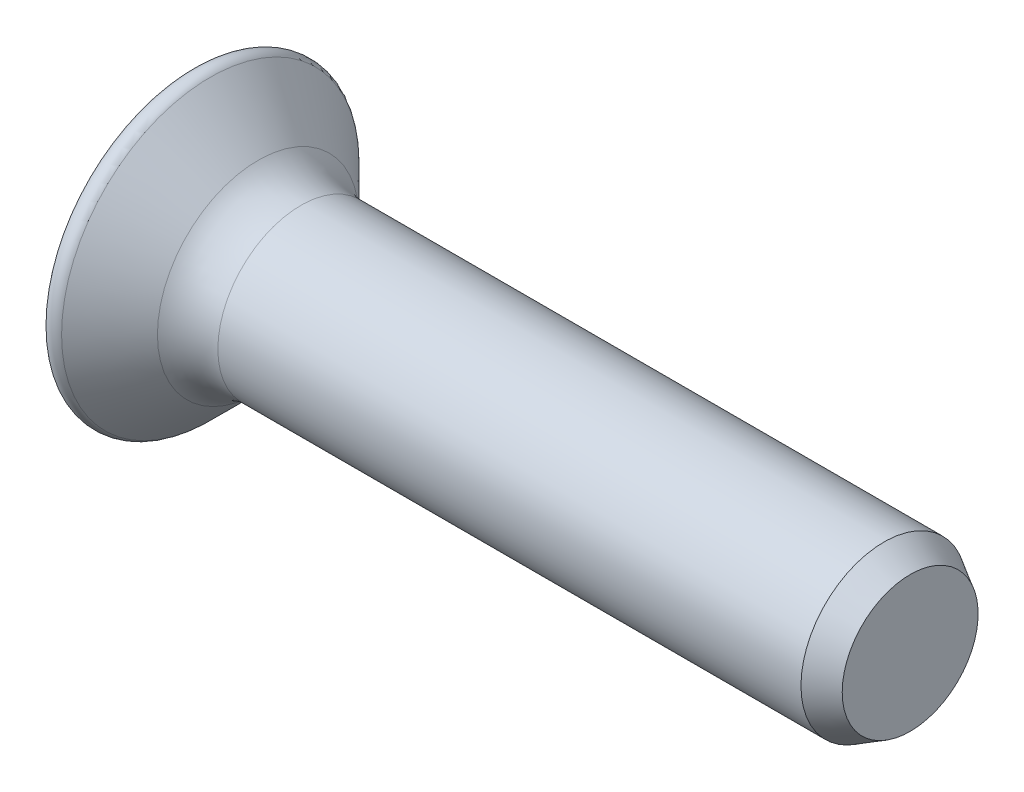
SolidWorks part; units mm, degrees
ref_plane "Front Plane" through (0, 0, 0) normal (0, 0, 1) x (1, 0, 0)
ref_plane "Top Plane" through (0, 0, 0) normal (0, 1, 0) x (1, 0, 0)
ref_plane "Right Plane" through (0, 0, 0) normal (1, 0, 0) x (0, 0, -1)
sketch "Sketch1" plane through (0, 0, 0) normal (0, 0, 1) x (1, 0, 0)
  line L0 (0, 0) -> (6.2784, 0) construction
  line L3 (-1.6, 0) -> (-1.6, -1.8061) construction
  line L4 (-1.6, 0) -> (8.4, 0)
  line L5 (0, 1.1) -> (8.4, 1.1)
  line L6 (8.4, 1.1) -> (8.4, 0)
  line L7 (0, 1.1) -> (-0.869, 1.969)
  arc A0 (-1.1, 1.9365) -> (-1.6, 0) centre (2.4, 0) ccw
  arc A1 (-1.1, 1.9365) -> (-0.869, 1.969) centre (-0.9723, 1.8658) cw
  dimension "D1" = 45
  dimension "rf" = 4
  dimension "l" = 9.5
  dimension "d" = 2.2
  dimension "k" = 1.1
  dimension "f" = 0.5
revolve "Revolve1" add sketch "Sketch1" angle 360 about L0
chamfer "Chamfer1" distance 0.2 angle 60 1 edges at (8.4, 0, 1.1)
sketch "Sketch5" plane through (0, 0, 0) normal (0, 0, 1) x (1, 0, 0)
  line L0 (0.3703, 0.825) -> (0.2069, 0.825)
  line L1 (0.2069, 0.825) -> (0.0481, 1.1)
  line L2 (0.3703, 0.825) -> (0.529, 1.1)
  line L3 (0.0481, 1.1) -> (0.0481, 1.35)
  line L4 (0.529, 1.1) -> (0.529, 1.35)
  line L5 (0.0481, 1.35) -> (0.529, 1.35)
  line L6 (0.2886, 0.825) -> (0.2886, 0) construction
  line L7 (0, 0) -> (7.3035, 0) construction
  line L9 (0, 1.1) -> (0, -1.1) construction
  line L12 (8.0536, 1.1) -> (0, 1.1) construction
  dimension "D2" = 60
  dimension "D3" = 0.25
  dimension "threadstart" = 0.2886
  dimension "minordia" = 1.65
  dimension "advance" = 0.4809
revolve "ThreadSchematic" [suppressed] cut sketch "Sketch5" angle 360 about L7
pattern_linear "ThdSchPat" [suppressed] count 18 spacing 0.4809 along (1, 0, 0)
sketch "Sketch2" plane through (0, 0, 0) normal (0, 0, 1) x (1, 0, 0)
  line L0 (0, 0) -> (5.7679, 0) construction
  line L1 (8.4, 0) -> (6.4947, 1.1)
  line L2 (8.4, 1.1) -> (8.4, 0) construction
  line L4 (6.4947, 1.1) -> (6.4947, 1.2)
  line L5 (6.4947, 1.2) -> (8.5, 1.2)
  line L6 (8.5, 1.2) -> (8.5, 0)
  line L7 (8.5, 0) -> (8.4, 0)
  point P5 (0, 1.1)
  dimension "D1" = 30
  dimension "D2" = 0.1
  dimension "D3" = 0.1
revolve "EndCone" [suppressed] cut sketch "Sketch2" angle 360 about L0
ref_plane "Plane4" through (-1.6, 0, 0) normal (1, 0, 0) x (0, 0, -1)
sketch "Sketch3" plane through (-1.6, 0, 0) normal (1, 0, 0) x (0, 0, -1)
  line L0 (0, 2.343) -> (0, -2.4842) construction
  line L1 (2.7661, 0) -> (-3.4558, 0) construction
  line L2 (-0.22, 1.1) -> (0.22, 1.1)
  line L3 (0.22, 1.1) -> (0.1467, 0.7333)
  line L4 (0, 0) -> (1.9578, 1.9578) construction
  line L5 (0.1467, 0.7333) -> (0.3614, 0.3614)
  line L6 (0.1467, 0.7333) -> (0, 0) construction
  line L7 (-0.1467, 0.7333) -> (-0.3614, 0.3614)
  line L8 (-0.22, 1.1) -> (-0.1467, 0.7333)
  line L9 (1.1, 0.22) -> (1.1, -0.22)
  line L10 (1.1, -0.22) -> (0.7333, -0.1467)
  line L11 (0.7333, -0.1467) -> (0.3614, -0.3614)
  line L12 (0.7333, 0.1467) -> (0.3614, 0.3614)
  line L13 (1.1, 0.22) -> (0.7333, 0.1467)
  line L14 (0.22, -1.1) -> (-0.22, -1.1)
  line L15 (-0.22, -1.1) -> (-0.1467, -0.7333)
  line L16 (-0.1467, -0.7333) -> (-0.3614, -0.3614)
  line L17 (0.1467, -0.7333) -> (0.3614, -0.3614)
  line L18 (0.22, -1.1) -> (0.1467, -0.7333)
  line L19 (-1.1, -0.22) -> (-1.1, 0.22)
  line L20 (-1.1, 0.22) -> (-0.7333, 0.1467)
  line L21 (-0.7333, 0.1467) -> (-0.3614, 0.3614)
  line L22 (-0.7333, -0.1467) -> (-0.3614, -0.3614)
  line L23 (-1.1, -0.22) -> (-0.7333, -0.1467)
  point P14 (0, 1.1)
  point P23 (1.1, 0)
  point P30 (0, -1.1)
  point P37 (-1.1, 0)
  dimension "D1" = 45
  dimension "m" = 2.2
  dimension "D3" = 0.44
  dimension "D4" = 75
  dimension "D5" = 1.4667
extrude "Cut-Extrude1" cut sketch "Sketch3" along normal blind 0.8 draft 6
sketch "Sketch4" plane through (-1.6, 0, 0) normal (1, 0, 0) x (0, 0, -1)
  line L0 (0, 2.1951) -> (0, -2.1951) construction
  line L1 (2.1996, 0) -> (-2.3835, 0) construction
  line L2 (-0.9723, -0.9723) -> (0.9723, 0.9723) construction
  line L3 (1.1, 0.275) -> (-1.1, 0.275)
  line L4 (1.1, 0.275) -> (1.1, -0.275)
  line L5 (1.1, -0.275) -> (-1.1, -0.275)
  line L6 (-1.1, 0.275) -> (-1.1, -0.275)
  line L7 (0.275, 1.1) -> (-0.275, 1.1)
  line L8 (0.275, 1.1) -> (0.275, -1.1)
  line L9 (0.275, -1.1) -> (-0.275, -1.1)
  line L10 (-0.275, 1.1) -> (-0.275, -1.1)
  line L11 (0.9723, 0.9723) -> (0.4468, 0.275)
  line L12 (0.9723, 0.9723) -> (0.275, 0.4468)
  line L13 (0.275, 0.4468) -> (-0.275, 0.4468) construction
  line L14 (0, 0) -> (-0.9723, 0.9723) construction
  line L15 (-0.9723, -0.9723) -> (-0.275, -0.4468)
  line L16 (-0.9723, -0.9723) -> (-0.4468, -0.275)
  line L17 (-0.275, 0.4468) -> (-0.9723, 0.9723)
  line L18 (-0.9723, 0.9723) -> (-0.4468, 0.275)
  line L19 (-0.4468, -0.275) -> (-0.4468, 0.275) construction
  line L20 (0.4468, -0.275) -> (0.9723, -0.9723)
  line L21 (0.9723, -0.9723) -> (0.275, -0.4468)
  circle A0 centre (0, 0) radius 1.375 construction
  dimension "D1" = 2.75
  dimension "D2" = 0.55
  dimension "m" = 2.2
  dimension "D3" = 45
  dimension "D4" = 8
  dimension "D5" = 45
extrude "TypeZ" [suppressed] cut sketch "Sketch4" along normal blind 0.8
fillet "Fillet1" radius 0.8 1 edges at (0, 0, 1.1)
equation "\"D1@ThreadCosmetic\" = \"l@Sketch1\" - \"D1@Chamfer1\""
equation "\"minordia@sketch5\" = \"D2@ThreadCosmetic\""
equation "\"D1@Plane4\" = \"K@Sketch1\" + \"f@Sketch1\""
equation "\"D5@Sketch3\" = \"m@Sketch3\" * 2 / 3"
equation "\"D3@Sketch3\" = \"m@Sketch3\" / 5"
equation "\"D1@Cut-Extrude1\" = (  \"K@Sketch1\" + \"f@Sketch1\"  ) / 2"
equation "\"m@Sketch4\" = \"m@Sketch3\""
equation "\"D2@Sketch4\" =  \"m@Sketch4\" / 4"
equation "\"D1@TypeZ\" = (  \"K@Sketch1\"  + \"f@Sketch1\" ) / 2"
equation "\"D1@Sketch4\" = \"m@Sketch4\" * 5 / 4"
equation "\"threadstart@Sketch5\" = \"advance@Sketch5\"*0.6"
equation "\"D1@ThdSchPat\" = int(((\"l@Sketch1\"-\"k@Sketch1\")/\"advance@Sketch5\") + 0.8)"
equation "\"D3@ThdSchPat\" = \"advance@Sketch5\""
